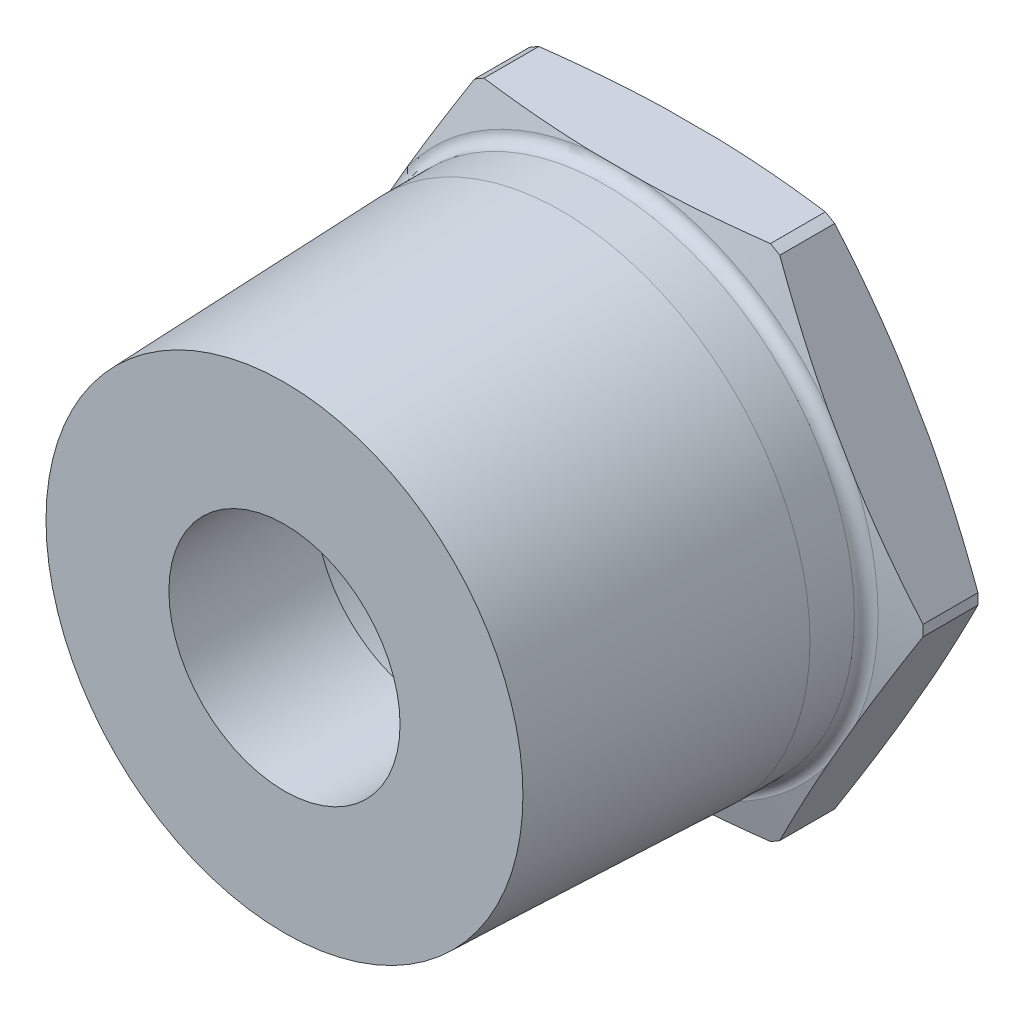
SolidWorks part; units mm, degrees
ref_plane "Front Plane" through (0, 0, 0) normal (0, 0, 1) x (1, 0, 0)
ref_plane "Top Plane" through (0, 0, 0) normal (0, 1, 0) x (1, 0, 0)
ref_plane "Right Plane" through (0, 0, 0) normal (1, 0, 0) x (0, 0, -1)
sketch "Sketch4" plane through (0, 0, 0) normal (1, 0, 0) x (0, 0, -1)
  line L0 (-0.762, 12.7) -> (-3.937, 12.7)
  line L1 (-3.937, 12.7) -> (-3.937, 11.176)
  line L2 (-4.445, 10.668) -> (-6.35, 10.668)
  line L3 (-6.35, 10.668) -> (-18.2372, 10.2352)
  line L4 (-18.2372, 10.2352) -> (-18.2372, 0)
  line L5 (-18.2372, 0) -> (-0.762, 0)
  line L6 (-0.762, 0) -> (-0.762, 12.7)
  line L10 (1.6991, 0) -> (-20.1593, 0) construction
  arc A0 (-3.937, 11.176) -> (-4.445, 10.668) centre (-4.445, 11.176) cw
  dimension "D8" = 0.508
  dimension "D1" = 0.762
  dimension "D2" = 3.175
  dimension "D3" = 5.588
  dimension "D4" = 2.085
  dimension "D5" = 17.4752
  dimension "D6" = 21.336
  dimension "D7" = 25.4
revolve "Revolve2" add sketch "Sketch4" angle 360 about L10
chamfer "Chamfer1" distance 1.524 angle 15 2 edges at (-12.7, 0, 0.762) (-12.7, 0, 3.937)
sketch "Sketch5" plane through (0, 0, 0.762) normal (0, 0, -1) x (-1, 0, 0)
  line L1 (-6.4158, 11.1125) -> (-12.8316, 0)
  line L2 (-12.8316, 0) -> (-6.4158, -11.1125)
  line L3 (-6.4158, -11.1125) -> (6.4158, -11.1125)
  line L4 (6.4158, -11.1125) -> (12.8316, 0)
  line L5 (12.8316, 0) -> (6.4158, 11.1125)
  line L6 (6.4158, 11.1125) -> (-6.4158, 11.1125)
  circle A0 centre (0, 0) radius 11.1125 construction
  dimension "D1" = 22.225
extrude "Cut-Extrude1" cut sketch "Sketch5" against normal through all flip side to cut
hole_wizard "3/8 NPT Tapped Hole1" positions "Sketch7" profile "Sketch6" size "3/8" standard "ANSI Inch"
sketch "Sketch7" plane through (0, 0, 0.762) normal (0, 0, -1) x (-1, 0, 0)
  point P0 (0, 0)
  point P1 (0, 0)
sketch "Sketch6" plane through (0, 0, 0.762) normal (1, 0, 0) x (0, 1, 0)
  line L0 (0, 0) -> (0, 17.4752)
  line L1 (0, 17.4752) -> (4.9594, 17.4752)
  line L2 (-8.2632, 11.176) -> (-8.5978, 0) construction
  line L3 (4.9594, 17.4752) -> (4.9594, 11.176)
  line L4 (4.9594, 11.176) -> (8.2632, 11.176)
  line L5 (8.2632, 11.176) -> (8.5978, 0)
  line L7 (8.5978, 0) -> (0, 0)
  line L8 (0, -6.35) -> (0, 107.95) construction
  line L11 (-4.9594, 11.176) -> (-8.2632, 11.176) construction
  dimension "Thru Tap Drill Dia." = 9.9187
  dimension "Thru Tap Drill Depth" = 17.4752
  dimension "Thread Dia." = 17.1956
  dimension "Thread Angle" = 3.43
  dimension "Thread Depth" = 11.176
hole_wizard "7/16-20 Tapped Hole1" positions "Sketch8" profile "Sketch9" tap size "7/16-20" standard "ANSI Inch"
sketch "Sketch8" plane through (0, 0, 18.2372) normal (0, 0, 1) x (1, 0, 0)
  point P0 (0, 0)
sketch "Sketch9" plane through (0, 0, 18.2372) normal (1, 0, 0) x (0, -1, 0)
  line L0 (0, 0) -> (0, 17.4922)
  line L1 (0, 17.4922) -> (4.9606, 17.4922)
  line L2 (4.9606, 17.4922) -> (4.9606, 0)
  line L5 (4.9606, 0) -> (0, 0)
  line L11 (0, -6.35) -> (0, 107.95) construction
  dimension "Thru Tap Drill Dia." = 9.9212
  dimension "Thru Tap Drill Depth" = 17.4922
